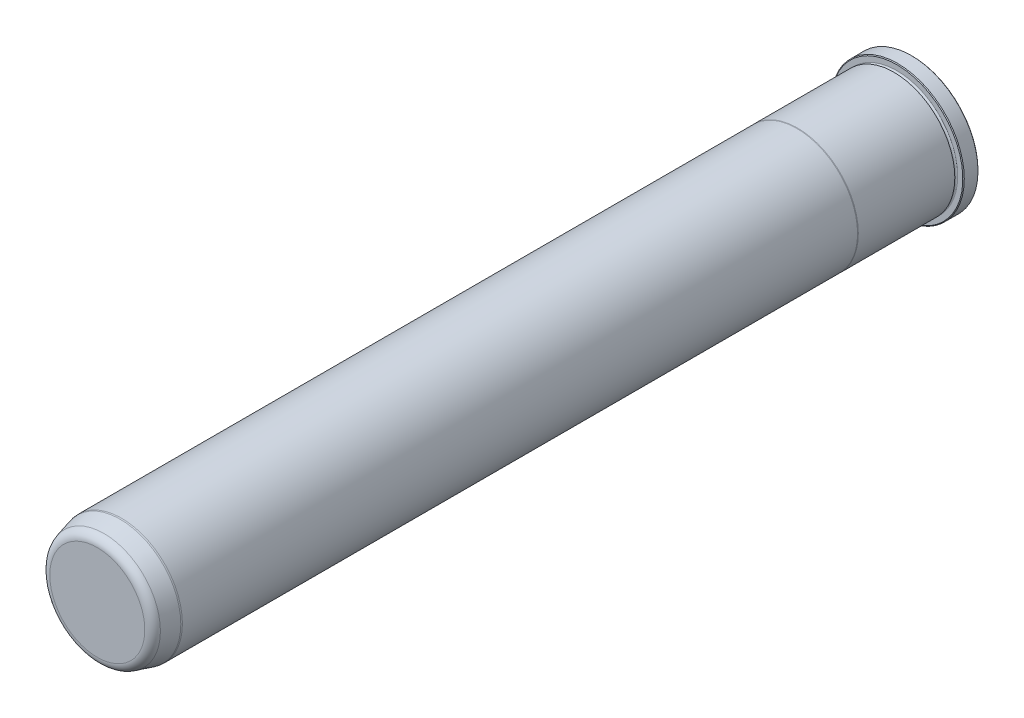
SolidWorks part; units mm, degrees
ref_plane "Front Plane" through (0, 0, 0) normal (0, 0, 1) x (1, 0, 0)
ref_plane "Top Plane" through (0, 0, 0) normal (0, 1, 0) x (1, 0, 0)
ref_plane "Right Plane" through (0, 0, 0) normal (1, 0, 0) x (0, 0, -1)
sketch "Sketch1" plane through (0, 0, 0) normal (1, 0, 0) x (0, 0, -1)
  line L0 (0, 0) -> (0, 34.798)
  line L1 (0, 34.798) -> (-7.9248, 34.798)
  line L2 (-7.9248, 34.798) -> (-7.9248, 31.7373)
  line L3 (-7.9248, 30.9753) -> (-9.4488, 30.9753) construction
  line L4 (-9.4488, 31.7373) -> (-9.4488, 31.7627)
  line L5 (-9.4488, 31.7627) -> (-59.8348, 31.7627)
  line L6 (-59.8348, 31.7627) -> (-60.198, 31.7373)
  line L7 (-60.198, 31.7373) -> (-412.75, 31.7373)
  line L9 (-425.45, 28.4719) -> (-425.45, 0)
  line L10 (-425.45, 0) -> (0, 0)
  line L11 (0, 0) -> (13.6287, 0) construction
  line L12 (-412.75, 31.7373) -> (-413.512, 31.6706)
  line L13 (-413.512, 31.6706) -> (-425.45, 28.4719)
  arc A0 (-9.4488, 31.7373) -> (-7.9248, 31.7373) centre (-8.6868, 31.7373) ccw
  dimension "D14" = 1.524
  dimension "D1" = 7.9248
  dimension "D2" = 1.524
  dimension "D3" = 69.596
  dimension "D4" = 63.5254
  dimension "D5" = 60.198
  dimension "D6" = 425.45
  dimension "D7" = 0.7874
  dimension "D8" = 4
  dimension "D9" = 63.4746
  dimension "D10" = 5
  dimension "D11" = 15
  dimension "D12" = 0.762
  dimension "D13" = 12.7
revolve "Revolve1" add sketch "Sketch1" angle 360 about L11
fillet "Fillet6" radius 4.7625 1 edges at (28.4719, 0, 425.45)
chamfer "Chamfer1" distance 0.381 angle 45 2 edges at (34.798, 0, 0) (34.798, 0, 7.9248)
